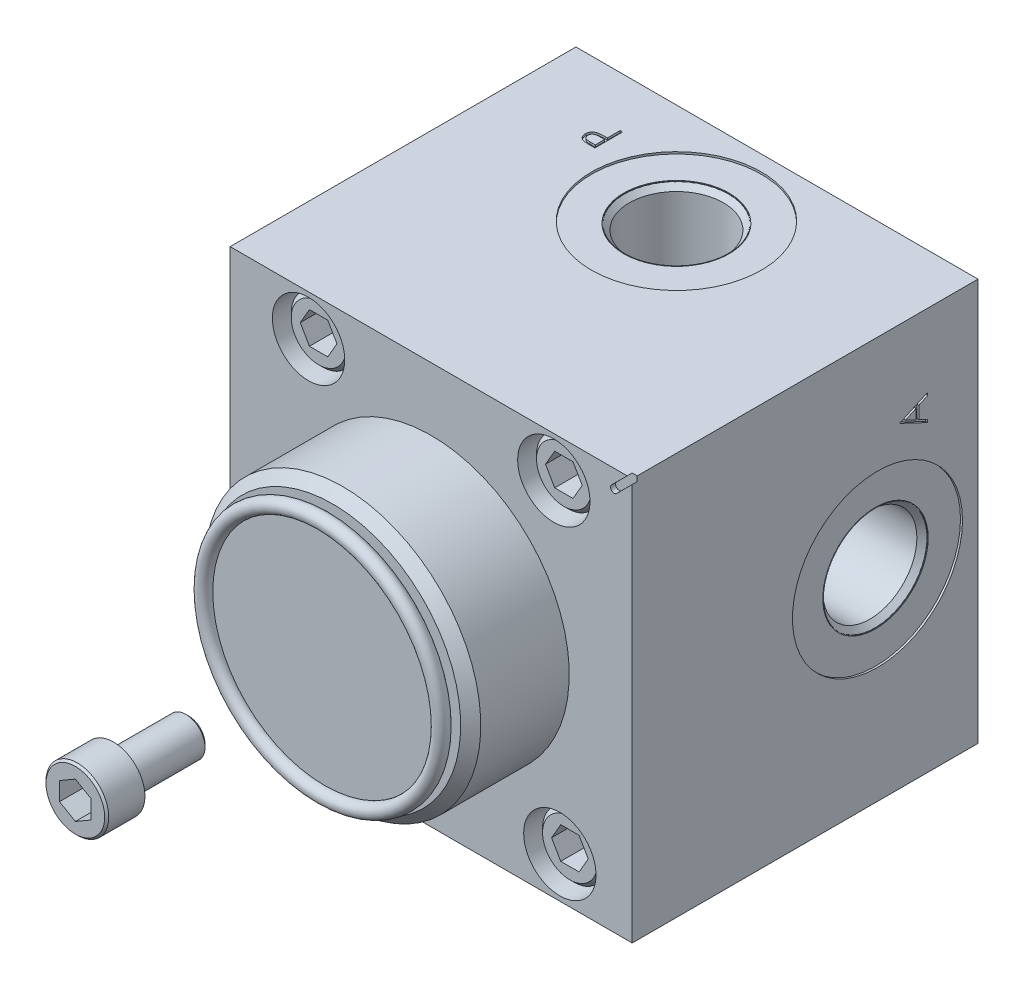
SolidWorks part; units mm, degrees
ref_plane "Front Plane" through (0, 0, 0) normal (0, 0, 1) x (1, 0, 0)
ref_plane "Top Plane" through (0, 0, 0) normal (0, 1, 0) x (1, 0, 0)
ref_plane "Right Plane" through (0, 0, 0) normal (1, 0, 0) x (0, 0, -1)
imported_body "Imported1"
imported_body "Imported2"
imported_body "Surface-Imported1"
imported_body "Surface-Imported2"
imported_body "Surface-Imported3"
imported_body "Surface-Imported4"
imported_body "Surface-Imported5"
imported_body "Surface-Imported6"
imported_body "Surface-Imported7"
imported_body "Surface-Imported8"
imported_body "Surface-Imported9"
imported_body "Surface-Imported10"
imported_body "Surface-Imported11"
imported_body "Surface-Imported12"
sketch "Sketch1" plane through (0, 0, 0) normal (1, 0, 0) x (0, 0, -1)
  line L0 (0, 0) -> (-43.688, 0) construction
  line L1 (0, 0) -> (0, 50.8) construction
  text T0 "<r90>A</r>"
  point P5 (0, 0)
  dimension "D1" = 38.1
  dimension "D2" = 6.35
extrude "Cut-Extrude1" cut sketch "Sketch1" against normal blind 0.254
sketch "Sketch2" plane through (0, 50.8, 0) normal (0, 1, 0) x (1, 0, 0)
  line L0 (0, -43.053) -> (0, 0) construction
  line L1 (0, 0) -> (-50.8, 0) construction
  text T0 "<r180>P</r>"
  dimension "D1" = 38.1
  dimension "D2" = 6.35
extrude "Cut-Extrude2" cut sketch "Sketch2" against normal blind 0.254
sketch "Sketch5" plane through (-50.8, 0, 0) normal (-1, 0, 0) x (0, 0, 1)
  line L0 (43.688, 50.8) -> (0, 50.8) construction
  line L1 (0, 50.8) -> (0, 0) construction
  text T0 "<r-90>B</r>"
  dimension "D1" = 38.1
  dimension "D2" = 6.35
extrude "Cut-Extrude6" cut sketch "Sketch5" against normal blind 0.254
sketch "Sketch6" plane through (0, 0, 0) normal (0, -1, 0) x (1, 0, 0)
  line L0 (-50.8, 43.688) -> (-50.8, 0) construction
  line L1 (-50.8, 0) -> (0, 0) construction
  text T0 "T"
  dimension "D1" = 38.1
  dimension "D2" = 6.35
extrude "Cut-Extrude7" cut sketch "Sketch6" against normal blind 0.254
